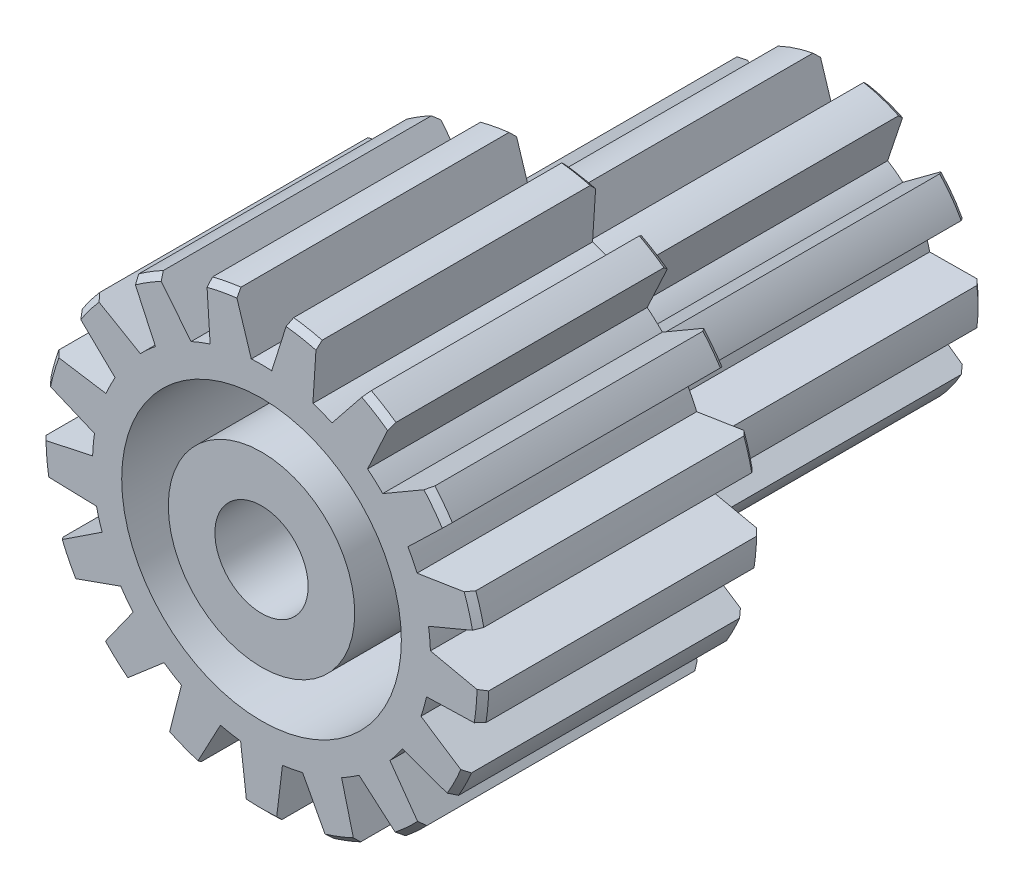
SolidWorks part; units mm, degrees
ref_plane "Plan1" through (0, 0, 0) normal (0, 0, 1) x (1, 0, 0)
ref_plane "Plan2" through (0, 0, 0) normal (0, 1, 0) x (1, 0, 0)
ref_plane "Plan3" through (0, 0, 0) normal (1, 0, 0) x (0, 0, -1)
sketch "Diamètre primitif" plane through (0, 0, 0) normal (0, 0, 1) x (1, 0, 0)
  line L0 (0, 0) -> (0.5, 0) construction
  circle A0 centre (0, 0) radius 4.25
  point P3 (0, 0)
  dimension "D1" = 8.5
  dimension "D2" = 0.5
sketch "Esquisse2" plane through (0, 0, 0) normal (0, 0, 1) x (1, 0, 0)
  circle A0 centre (0, 0) radius 4.75
  dimension "D1" = 9.5
extrude "Diamètre de tête" add sketch "Esquisse2" along normal mid plane 6
chamfer "Chanfreins" distance 0.125 angle 45
sketch "Esquisse3" plane through (0, 0, 0) normal (0, 0, 1) x (1, 0, 0)
  line L0 (0, 0) -> (0, 4.75) construction
  line L1 (-0.2196, 3.6183) -> (-0.5658, 4.7162)
  line L2 (0.2196, 3.6183) -> (0.5658, 4.7162)
  arc A0 (0.2196, 3.6183) -> (-0.2196, 3.6183) centre (0, 0) ccw
  circle A1 centre (0, 0) radius 4.75 construction
  arc A2 (0.5658, 4.7162) -> (-0.5658, 4.7162) centre (0, 0) ccw
  point P1 (-0.3927, 4.1673)
  point P10 (0.3927, 4.1673)
  dimension "D1" = 7.25
  dimension "D2" = 0.7854
  dimension "D3" = 325
extrude "Creux dent" cut sketch "Esquisse3" against normal through all and the other way through all
pattern_circular "Répétition" count 17 over 360
sketch "Esquisse5" plane through (0, 0, -3) normal (0, 0, -1) x (-1, 0, 0)
  circle A0 centre (0, 0) radius 2
  dimension "D1" = 4
extrude "Extrusion1" add sketch "Esquisse5" along normal blind 6.5
ref_plane "Plan pignon" through (0, 0, -9.5) normal (0, 0, -1) x (-1, 0, 0)
sketch "Primitif" plane through (0, 0, -9.5) normal (0, 0, -1) x (-1, 0, 0)
  line L0 (0, 0) -> (0.5, 0) construction
  circle A0 centre (0, 0) radius 2.5
  dimension "D1" = 5
  dimension "D2" = 0.5
sketch "Esquisse31" plane through (0, 0, -9.5) normal (0, 0, -1) x (-1, 0, 0)
  circle A0 centre (0, 0) radius 3
  dimension "D1" = 6
extrude "Pignon" add sketch "Esquisse31" against normal up to surface (6.5 mm away)
chamfer "Chanfreins1" distance 0.125 angle 45
sketch "Esquisse41" plane through (0, 0, -9.5) normal (0, 0, -1) x (-1, 0, 0)
  line L0 (0, 0) -> (0, 3) construction
  line L1 (-0.202, 1.8641) -> (-0.5444, 2.9502)
  line L2 (0.202, 1.8641) -> (0.5444, 2.9502)
  arc A0 (0.202, 1.8641) -> (-0.202, 1.8641) centre (0, 0) ccw
  circle A1 centre (0, 0) radius 3 construction
  arc A2 (0.5444, 2.9502) -> (-0.5444, 2.9502) centre (0, 0) ccw
  circle A4 centre (0, 0) radius 2.5 construction
  point P1 (-0.3927, 2.469)
  point P10 (0.3927, 2.469)
  dimension "D1" = 3.75
  dimension "D2" = 0.7854
  dimension "D3" = 35
extrude "Creux dent1" cut sketch "Esquisse41" against normal up to surface (6.5 mm away)
pattern_circular "Répétition circulaire1" count 10 over 360
sketch "Esquisse4" plane through (0, 0, 3) normal (0, 0, 1) x (1, 0, 0)
  circle A0 centre (0, 0) radius 1
  dimension "D1" = 2
extrude "Enlèv. mat.-Extru.1" cut sketch "Esquisse4" against normal through all
sketch "Esquisse42" plane through (0, 0, 3) normal (0, 0, 1) x (1, 0, 0)
  circle A0 centre (0, 0) radius 2.5
  dimension "D1" = 5
extrude "Enlèv. de mat.-Extru.-Mince2" cut sketch "Esquisse42" against normal blind 5 thin
equation "\"D1@Esquisse2\" = \"D1@Diamètre primitif\" + 2 * \"D2@Diamètre primitif\""
equation "\"D1@Chanfreins\" = 0.25*\"D2@Diamètre primitif\""
equation "\"D1@Esquisse3\" = \"D1@Diamètre primitif\"-2.5*\"D2@Diamètre primitif\""
equation "\"D2@Esquisse3\"=3.14159*\"D2@Diamètre primitif\"/2"
equation "\"D1@Répétition\" = \"D1@Diamètre primitif\"/\"D2@Diamètre primitif\""
equation "\"D1@Esquisse31\" = \"D1@Primitif\"+2*\"D2@Primitif\""
equation "\"D1@Chanfreins1\" = 0.25*\"D2@Primitif\""
equation "\"D1@Esquisse41\" = \"D1@Primitif\"-2.5*\"D2@Primitif\""
equation "\"D2@Esquisse41\" = 3.14159/2*\"D2@Primitif\""
equation "\"D1@Répétition circulaire1\"=\"D1@Primitif\"/\"D2@Primitif\""
